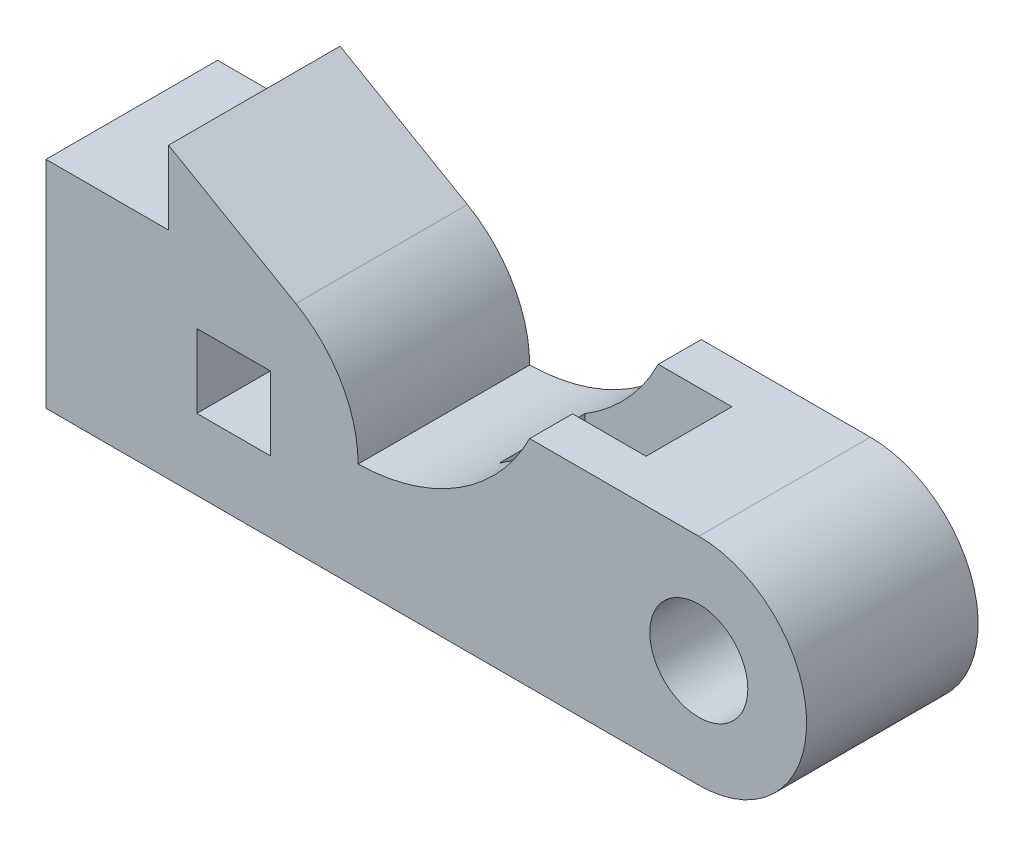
SolidWorks part; units mm, degrees
ref_plane "Front Plane" through (0, 0, 0) normal (0, 0, 1) x (1, 0, 0)
ref_plane "Top Plane" through (0, 0, 0) normal (0, 1, 0) x (1, 0, 0)
ref_plane "Right Plane" through (0, 0, 0) normal (1, 0, 0) x (0, 0, -1)
sketch "Sketch2" plane through (0, 0, 0) normal (0, 0, 1) x (1, 0, 0)
  line L0 (0, 0) -> (0, 88)
  line L1 (0, 88) -> (50, 88)
  line L2 (50, 88) -> (50, 118)
  line L3 (50, 118) -> (101.9615, 88)
  line L4 (197.3649, 88) -> (266.3649, 88)
  line L5 (266.3649, 0) -> (0, 0)
  line L7 (91.5581, 29) -> (61.5581, 29)
  line L8 (91.5581, 29) -> (91.5581, 59)
  line L9 (91.5581, 59) -> (61.5581, 59)
  line L10 (61.5581, 29) -> (61.5581, 59)
  line L11 (91.5581, 29) -> (61.5581, 59) construction
  line L12 (91.5581, 59) -> (61.5581, 29) construction
  arc A0 (101.9615, 88) -> (127.3649, 44) centre (76.5581, 44) cw
  arc A1 (127.3649, 44) -> (197.3649, 88) centre (125.916, 123.9869) ccw
  arc A2 (266.3649, 88) -> (266.3649, 0) centre (266.3649, 44) cw
  point P14 (0, 44)
extrude "Boss-Extrude1" add sketch "Sketch2" along normal mid plane 70
sketch "Sketch3" plane through (0, 88, 0) normal (0, 1, 0) x (1, 0, 0)
  line L0 (197.3649, -35) -> (197.3649, 35) construction
  line L1 (167.3649, -17.5) -> (227.3649, -17.5)
  line L2 (167.3649, -17.5) -> (167.3649, 17.5)
  line L3 (167.3649, 17.5) -> (227.3649, 17.5)
  line L4 (227.3649, -17.5) -> (227.3649, 17.5)
  line L5 (167.3649, -17.5) -> (227.3649, 17.5) construction
  line L6 (167.3649, 17.5) -> (227.3649, -17.5) construction
  point P0 (197.3649, 0)
  point P7 (219.2476, -17.5)
  dimension "D1" = 35
  dimension "D2" = 60
extrude "Cut-Extrude1" cut sketch "Sketch3" against normal through all
sketch "Sketch4" plane through (0, 0, 0) normal (0, 0, 1) x (1, 0, 0)
  circle A0 centre (266.3649, 44) radius 20
  dimension "D1" = 40
extrude "Cut-Extrude2" cut sketch "Sketch4" against normal through all both and the other way through all
equation "\"A\" = 88"
equation "\"B\"= 69"
equation "\"D1@Sketch2\"=\"B\""
equation "\"D2@Sketch2\"=\"A\""
